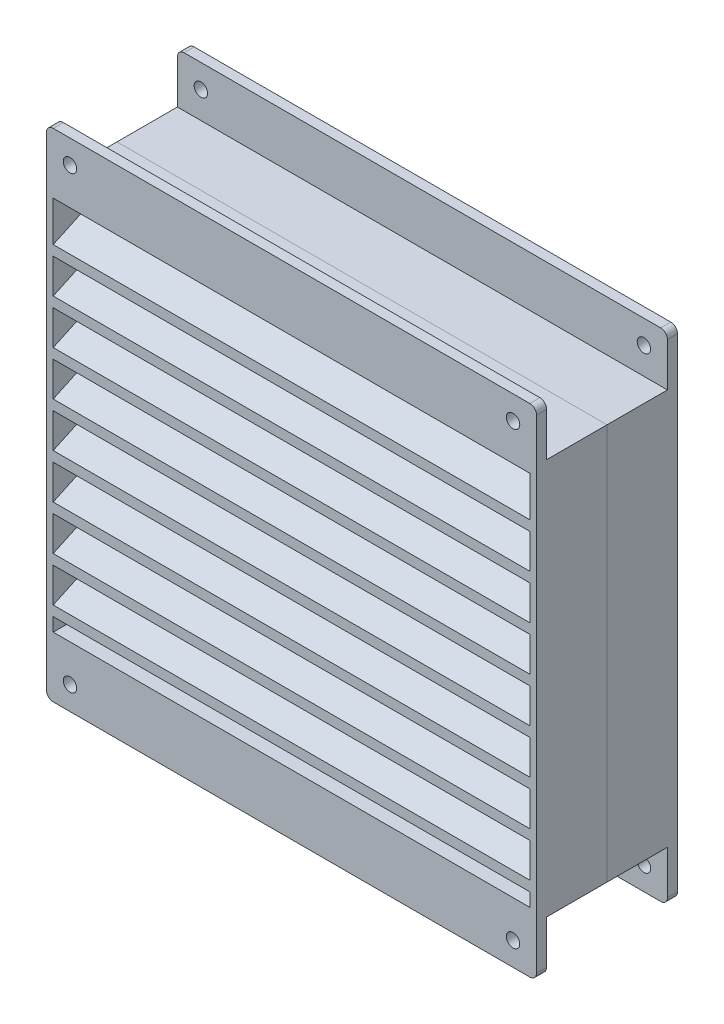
SolidWorks part; units mm, degrees
ref_plane "Спереди" through (0, 0, 0) normal (0, 0, 1) x (1, 0, 0)
ref_plane "Сверху" through (0, 0, 0) normal (0, 1, 0) x (1, 0, 0)
ref_plane "Справа" through (0, 0, 0) normal (1, 0, 0) x (0, 0, -1)
sketch "Эскиз1" plane through (0, 0, 0) normal (1, 0, 0) x (0, 0, -1)
  line L0 (0, 0) -> (0, 118) construction
  line L1 (0, 0) -> (-21, 0)
  line L2 (0, 0) -> (0, 3)
  line L3 (0, 3) -> (-21, 3)
  line L4 (-21, 0) -> (-21, 3)
  line L5 (0, 115) -> (-21, 115)
  line L6 (0, 115) -> (0, 118)
  line L7 (0, 118) -> (-21, 118)
  line L8 (-21, 115) -> (-21, 118)
  line L9 (0, 7) -> (-15, 13.9946)
  line L10 (-15, 13.9946) -> (-15, 16.9946)
  line L11 (-15, 16.9946) -> (0, 10)
  line L12 (0, 10) -> (0, 7)
  line L13 (-15, 27.2803) -> (-15, 30.2803)
  line L14 (-15, 30.2803) -> (0, 23.2857)
  line L15 (0, 23.2857) -> (0, 20.2857)
  line L16 (0, 20.2857) -> (-15, 27.2803)
  line L17 (-15, 40.566) -> (-15, 43.566)
  line L18 (-15, 43.566) -> (0, 36.5714)
  line L19 (0, 36.5714) -> (0, 33.5714)
  line L20 (0, 33.5714) -> (-15, 40.566)
  line L21 (-15, 53.8518) -> (-15, 56.8518)
  line L22 (-15, 56.8518) -> (0, 49.8571)
  line L23 (0, 49.8571) -> (0, 46.8571)
  line L24 (0, 46.8571) -> (-15, 53.8518)
  line L25 (-15, 67.1375) -> (-15, 70.1375)
  line L26 (-15, 70.1375) -> (0, 63.1429)
  line L27 (0, 63.1429) -> (0, 60.1429)
  line L28 (0, 60.1429) -> (-15, 67.1375)
  line L29 (-15, 80.4232) -> (-15, 83.4232)
  line L30 (-15, 83.4232) -> (0, 76.4286)
  line L31 (0, 76.4286) -> (0, 73.4286)
  line L32 (0, 73.4286) -> (-15, 80.4232)
  line L49 (-15, 93.7089) -> (-15, 96.7089)
  line L50 (-15, 96.7089) -> (0, 89.7143)
  line L51 (0, 89.7143) -> (0, 86.7143)
  line L52 (0, 86.7143) -> (-15, 93.7089)
  line L53 (-15, 106.9946) -> (-15, 109.9946)
  line L54 (-15, 109.9946) -> (0, 103)
  line L55 (0, 103) -> (0, 100)
  line L56 (0, 100) -> (-15, 106.9946)
  dimension "D2" = 118
  dimension "D3" = 3
  dimension "D4" = 21
  dimension "D5" = 4
  dimension "D6" = 12
  dimension "D7" = 15
  dimension "D8" = 65
  dimension "D9" = 3.2911
  dimension "D1" = 8
extrude "Бобышка-Вытянуть1" add sketch "Эскиз1" along normal blind 146
sketch "Эскиз2" plane through (0, 0, 0) normal (0, 0, -1) x (-1, 0, 0)
  line L0 (-146, 0) -> (0, 0) construction
  line L1 (-146, 118) -> (-144, 118)
  line L2 (-146, 118) -> (-146, 0)
  line L3 (-146, 0) -> (-144, 0)
  line L4 (-144, 118) -> (-144, 0)
  line L6 (0, 118) -> (-2, 118)
  line L7 (0, 118) -> (0, 0)
  line L8 (0, 0) -> (-2, 0)
  line L9 (-2, 118) -> (-2, 0)
  dimension "D1" = 2
extrude "Бобышка-Вытянуть2" add sketch "Эскиз2" against normal up to surface (21 mm away)
sketch "Эскиз3" plane through (0, 0, 0) normal (0, 0, -1) x (-1, 0, 0)
  line L0 (0, 59) -> (-146, 59) construction
  line L1 (-146, 0) -> (0, 0)
  line L2 (-146, 0) -> (-146, -15)
  line L3 (-146, -15) -> (0, -15)
  line L4 (0, 0) -> (0, -15)
  line L5 (0, 0) -> (0, 118) construction
  line L6 (-146, 0) -> (-146, 118) construction
  line L7 (-73, -15) -> (-73, 0) construction
  line L8 (0, 118) -> (0, 133)
  line L9 (-146, 133) -> (0, 133)
  line L10 (-146, 118) -> (-146, 133)
  line L11 (-146, 118) -> (0, 118)
  circle A2 centre (-139, -8) radius 2
  circle A3 centre (-7, -8) radius 2
  circle A4 centre (-7, 126) radius 2
  circle A5 centre (-139, 126) radius 2
extrude "Бобышка-Вытянуть3" add sketch "Эскиз3" against normal blind 3
fillet "Скругление1" radius 2 4 edges at (0, 133, 1.5) (0, -15, 1.5) (146, -15, 1.5) (146, 133, 1.5)
mirror "Зеркальное отражение1" about plane through (146, 0, 21) normal (0, 0, -1)
equation "\"D4@Эскиз3\"=\"D3@Эскиз3\""
